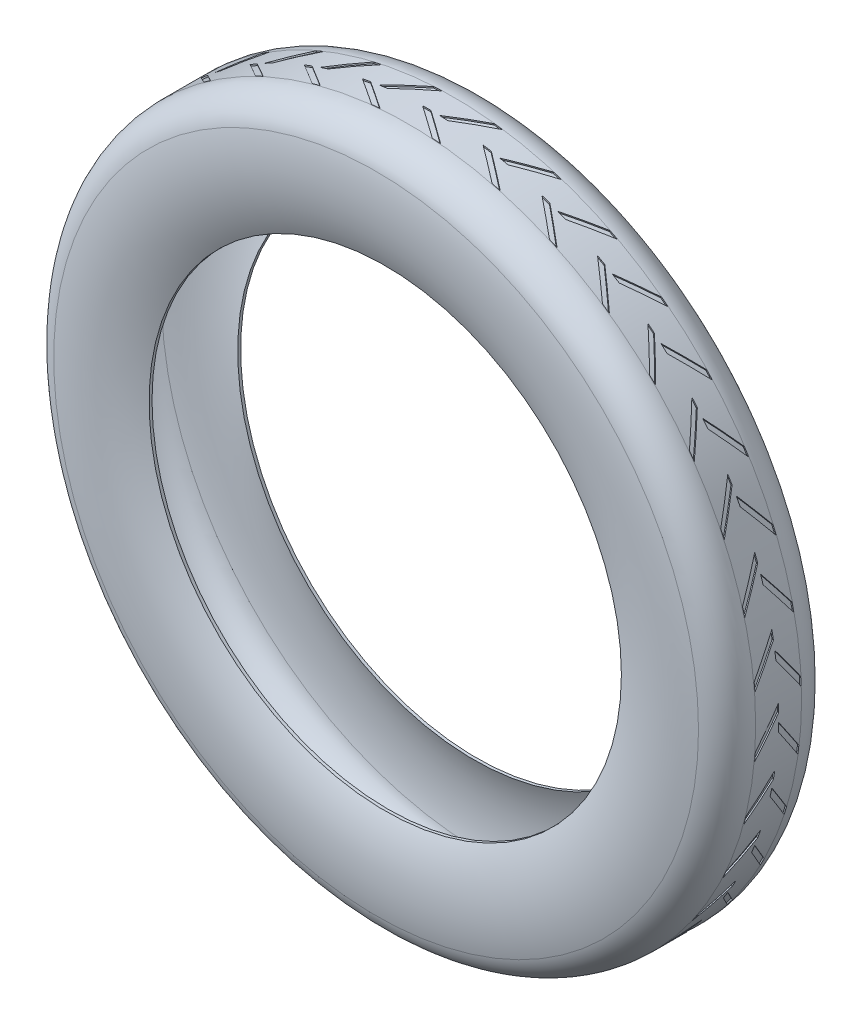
SolidWorks part; units mm, degrees
ref_plane "Front Plane" through (0, 0, 0) normal (0, 0, 1) x (1, 0, 0)
ref_plane "Top Plane" through (0, 0, 0) normal (0, 1, 0) x (1, 0, 0)
ref_plane "Right Plane" through (0, 0, 0) normal (1, 0, 0) x (0, 0, -1)
sketch "Sketch1" plane through (0, 0, 0) normal (1, 0, 0) x (0, 0, -1)
  line L0 (-238.8817, 0) -> (254.3572, 0) construction
  line L1 (0, 366.0243) -> (0, -377.1172) construction
  line L2 (-22.225, 336.55) -> (22.225, 336.55)
  line L5 (-44.3023, 228.6) -> (44.3023, 228.6)
  arc A0 (-53.1278, 312.0855) -> (-44.3023, 228.6) centre (70.4835, 282.9436) ccw
  arc A1 (53.1278, 312.0855) -> (44.3023, 228.6) centre (-70.4835, 282.9436) cw
  arc A2 (22.225, 336.55) -> (53.1278, 312.0855) centre (22.225, 304.8) cw
  arc A3 (-22.225, 336.55) -> (-53.1278, 312.0855) centre (-22.225, 304.8) ccw
  dimension "D2" = 44.45
  dimension "D4" = 127
  dimension "D1" = 31.75
  dimension "D5" = 673.1
  dimension "D3" = 457.2
  dimension "D6" = 38.6
revolve "Revolve1" add sketch "Sketch1" angle 360 about L0
shell "Shell1" thickness 2.54
ref_plane "Plane1" through (0, 355.6, 0) normal (0, 1, 0) x (-1, 0, 0)
sketch "Sketch4" plane through (0, 355.6, 0) normal (0, 1, 0) x (-1, 0, 0)
  line L0 (0, 0) -> (146.7568, 0) construction
  line L1 (0, 0) -> (-31.2097, 21.8533)
  line L3 (-31.2097, 21.8533) -> (-23.0817, 21.8533)
  line L4 (-23.0817, 21.8533) -> (8.128, 0)
  line L5 (8.128, 0) -> (0, 0)
  line L6 (42.418, 0) -> (11.2083, -21.8533)
  line L8 (11.2083, -21.8533) -> (19.3363, -21.8533)
  line L9 (19.3363, -21.8533) -> (50.546, 0)
  line L10 (50.546, 0) -> (42.418, 0)
  dimension "D1" = 8.128
  dimension "D2" = 8.128
  dimension "D3" = 38.1
  dimension "D4" = 145
  dimension "D5" = 38.1
  dimension "D6" = 145
  dimension "D7" = 34.29
wrap "Wrap1" sketch "Sketch4" wrap type deboss source sketch "Sketch4" thickness 1.27 parameters "D1"=1.27
pattern_circular "CirPattern1" count 36 over 360 about axis through (0, 0, -44.3023) along (0, 0, 1) of "Wrap1"
